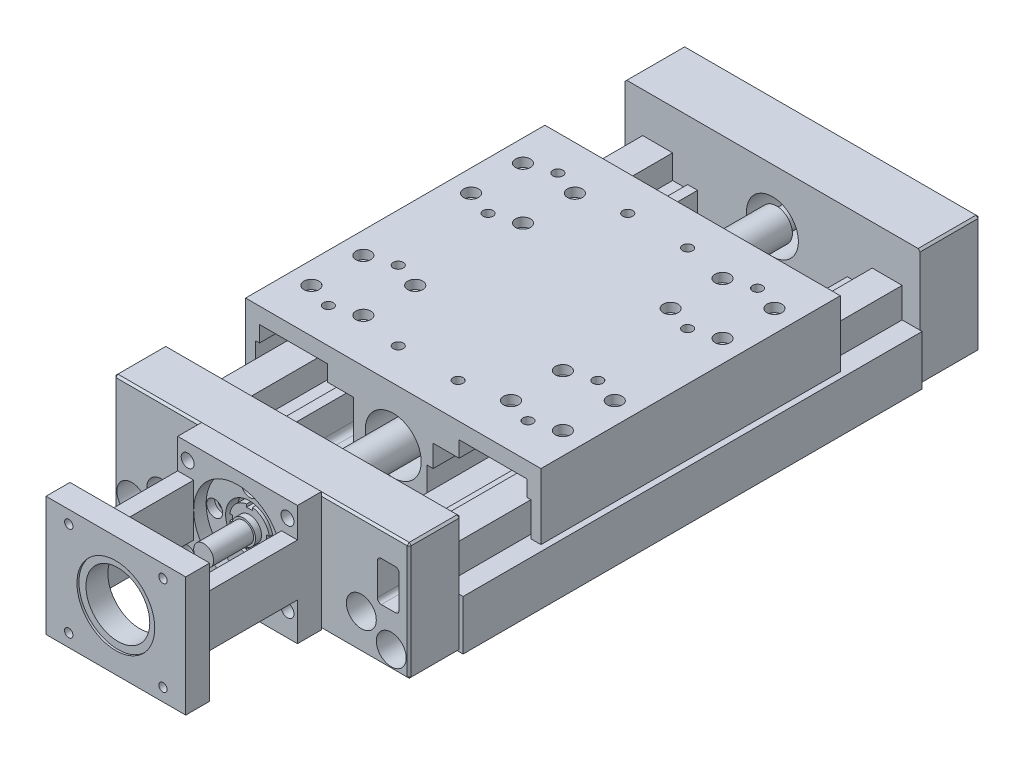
SolidWorks part; units mm, degrees
ref_plane "前视基准面" through (0, 0, 0) normal (0, 0, 1) x (1, 0, 0)
ref_plane "上视基准面" through (0, 0, 0) normal (0, 1, 0) x (1, 0, 0)
ref_plane "右视基准面" through (0, 0, 0) normal (1, 0, 0) x (0, 0, -1)
sketch "草图1" plane through (0, 0, 0) normal (0, 0, 1) x (1, 0, 0)
  line L0 (37.5, 30) -> (42.5, 30)
  line L1 (-75, 0) -> (75, 0)
  line L2 (-75, 0) -> (-75, 25)
  line L3 (-42.5, 30) -> (-37.5, 30)
  line L4 (75, 0) -> (75, 25)
  line L6 (-37.5, 30) -> (-37.5, 16)
  line L7 (-34.5, 13) -> (34.5, 13)
  line L8 (37.5, 30) -> (37.5, 16)
  line L10 (-42.5, 30) -> (-42.5, 28)
  line L11 (-42.5, 28) -> (-50, 28)
  line L12 (42.5, 30) -> (42.5, 28)
  line L13 (42.5, 28) -> (50, 28)
  line L14 (-50, 28) -> (-50, 25)
  line L15 (-50, 25) -> (-75, 25)
  line L18 (50, 28) -> (50, 25)
  line L19 (50, 25) -> (75, 25)
  arc A0 (37.5, 16) -> (34.5, 13) centre (34.5, 16) cw
  arc A1 (-37.5, 16) -> (-34.5, 13) centre (-34.5, 16) ccw
  point P0 (-75, 0)
  point P3 (75, 0)
  point P12 (37.5, 13)
  point P22 (-37.5, 13)
  dimension "D11" = 3
  dimension "D1" = 150
  dimension "D2" = 13
  dimension "D3" = 75
  dimension "D4" = 85
  dimension "D5" = 100
  dimension "D6" = 30
  dimension "D7" = 75
  dimension "D9" = 25
  dimension "D10" = 28
extrude "凸台-拉伸1" add sketch "草图1" along normal mid plane 230
ref_plane "基准面1" through (0, 0, 115) normal (0, 0, 1) x (1, 0, 0)
sketch "草图3" plane through (0, 0, 115) normal (0, 0, 1) x (1, 0, 0)
  line L1 (-74, 60) -> (74, 60)
  line L2 (-74, 60) -> (-74, 1)
  line L3 (-74, 1) -> (74, 1)
  line L4 (74, 60) -> (74, 1)
  dimension "D1" = 148
  dimension "D2" = 59
  dimension "D3" = 74
  dimension "D4" = 1
extrude "凸台-拉伸2" add sketch "草图3" along normal blind 26 separate body
ref_plane "基准面2" through (0, 0, -115) normal (0, 0, -1) x (-1, 0, 0)
sketch "草图4" plane through (0, 0, -115) normal (0, 0, -1) x (-1, 0, 0)
  line L1 (-74, 1) -> (74, 1)
  line L2 (-74, 1) -> (-74, 60)
  line L3 (-74, 60) -> (74, 60)
  line L4 (74, 1) -> (74, 60)
extrude "凸台-拉伸3" add sketch "草图4" along normal blind 30
sketch "草图5" plane through (0, 0, 141) normal (0, 0, 1) x (1, 0, 0)
  circle A0 centre (0, 33) radius 10
  dimension "D1" = 20
  dimension "D2" = 33
extrude "切除-拉伸1" cut sketch "草图5" against normal up to next
sketch "草图6" plane through (0, 0, 141) normal (0, 0, 1) x (1, 0, 0)
  circle A0 centre (0, 33) radius 14
  dimension "D1" = 28
extrude "切除-拉伸2" cut sketch "草图6" against normal blind 18
sketch "草图7" plane through (0, 0, -145) normal (0, 0, -1) x (-1, 0, 0)
  circle A0 centre (0, 33) radius 13
  dimension "D2" = 26
  dimension "D1" = 33
extrude "切除-拉伸3" cut sketch "草图7" against normal up to next
sketch "草图8" plane through (0, 0, 0) normal (0, 0, 1) x (1, 0, 0)
  line L0 (-20, 44) -> (-20, 24)
  line L1 (-74, 60) -> (74, 60)
  line L2 (-74, 60) -> (-74, 27)
  line L3 (-10, 14) -> (10, 14)
  line L4 (74, 60) -> (74, 27)
  line L5 (-20, 44) -> (-33, 44)
  line L6 (20, 44) -> (20, 33)
  line L7 (-33, 44) -> (-33, 52)
  line L8 (-33, 52) -> (-67, 52)
  line L9 (-67, 52) -> (-67, 44)
  line L10 (-67, 44) -> (-69, 44)
  line L11 (-69, 44) -> (-69, 27)
  line L12 (20, 33) -> (17, 33)
  line L13 (-69, 27) -> (-74, 27)
  line L14 (20, 44) -> (33, 44)
  line L15 (17, 33) -> (17, 21)
  line L16 (33, 44) -> (33, 52)
  line L17 (33, 52) -> (67, 52)
  line L18 (67, 52) -> (67, 44)
  line L19 (67, 44) -> (69, 44)
  line L20 (69, 44) -> (69, 27)
  line L21 (69, 27) -> (74, 27)
  line L22 (-20, 24) -> (-10, 14)
  line L23 (10, 14) -> (17, 21)
  circle A0 centre (0, 33) radius 10
  point P9 (-20, 14)
  point P12 (17, 14)
  dimension "D1" = 20
  dimension "D2" = 27
  dimension "D3" = 148
  dimension "D4" = 74
  dimension "D5" = 33
  dimension "D6" = 40
  dimension "D7" = 20
  dimension "D8" = 46
  dimension "D9" = 3
  dimension "D10" = 138
  dimension "D11" = 69
  dimension "D12" = 33
  dimension "D13" = 66
  dimension "D14" = 33
  dimension "D15" = 34
  dimension "D16" = 34
  dimension "D17" = 8
  dimension "D18" = 16
  dimension "D19" = 16
  dimension "D20" = 27
  dimension "D23" = 10
  dimension "D24" = 7
extrude "凸台-拉伸4" add sketch "草图8" along normal mid plane 150 separate body
sketch "草图9" plane through (0, 0, -75) normal (0, 0, -1) x (-1, 0, 0)
  line L1 (-33, 44) -> (30.2224, 44)
  line L2 (-33, 44) -> (-33, 7.4314)
  line L3 (-33, 7.4314) -> (30.2224, 7.4314)
  line L4 (30.2224, 44) -> (30.2224, 7.4314)
extrude "切除-拉伸4" cut sketch "草图9" against normal blind 60
sketch "草图10" plane through (0, 0, 75) normal (0, 0, 1) x (1, 0, 0)
  circle A0 centre (0, 33) radius 14
  dimension "D1" = 28
extrude "切除-拉伸5" cut sketch "草图10" against normal blind 50
hole_wizard "M6 螺纹孔1" positions "草图12" profile "草图11" tap size "M6" standard "GB"
sketch "草图12" plane through (0, 60, 0) normal (0, 1, 0) x (-1, 0, 0)
  point P0 (50, -57.5)
  point P1 (15, -57.5)
  point P3 (-15, -57.5)
  point P5 (-50, -57.5)
  point P7 (50, -22.5)
  point P9 (50, 22.5)
  point P11 (50, 57.5)
  point P17 (15, 57.5)
  point P23 (-15, 57.5)
  point P25 (-50, -22.5)
  point P27 (-50, 22.5)
  point P29 (-50, 57.5)
  dimension "D1" = 45
  dimension "D2" = 35
  dimension "D3" = 35
  dimension "D4" = 22.5
  dimension "D5" = 30
  dimension "D6" = 35
  dimension "D7" = 35
  dimension "D8" = 15
sketch "草图11" plane through (-50, 60, -57.5) normal (1, 0, 0) x (0, 0, 1)
  line L0 (0, 0) -> (0, 12.5022)
  line L1 (0, 12.5022) -> (2.5, 11)
  line L2 (2.5, 11) -> (2.5, 0)
  line L5 (2.5, 0) -> (0, 0)
  line L10 (0, 12.5022) -> (-2.5, 11) construction
  line L11 (0, -6.35) -> (0, 107.95) construction
  dimension "螺纹孔钻头直径" = 5
  dimension "螺纹孔钻头深度" = 11
  dimension "导头角度" = 118
hole_wizard "孔1" positions "草图15" profile "草图14" legacy
sketch "草图15" plane through (0, 60, 0) normal (0, 1, 0) x (-1, 0, 0)
  point P0 (-63, -53)
  point P1 (-63, -27)
  point P3 (-37, -53)
  point P5 (-37, -27)
  point P7 (-63, 27)
  point P9 (-63, 53)
  point P11 (-37, 27)
  point P13 (-37, 53)
  point P15 (63, 53)
  point P17 (63, 27)
  point P19 (37, 27)
  point P21 (37, 53)
  point P23 (63, -27)
  point P25 (63, -53)
  point P27 (37, -53)
  point P29 (37, -27)
  dimension "D1" = 26
  dimension "D2" = 26
  dimension "D3" = 26
  dimension "D4" = 26
  dimension "D5" = 54
  dimension "D6" = 27
  dimension "D7" = 74
  dimension "D8" = 37
sketch "草图14" plane through (63, 60, -53) normal (1, 0, 0) x (0, 0, 1)
  line L0 (0, 0) -> (0, 100)
  line L1 (0, 100) -> (2.25, 100)
  line L2 (2.25, 100) -> (2.25, 4.5)
  line L3 (2.25, 4.5) -> (3.75, 4.5)
  line L4 (3.75, 4.5) -> (3.75, 0)
  line L5 (3.75, 0) -> (0, 0)
  line L6 (0, 110) -> (0, -10) construction
  dimension "直径" = 4.5
  dimension "深度" = 100
  dimension "柱坑直径" = 7.5
  dimension "柱坑深度" = 4.5
ref_plane "基准面3" through (0, 33, 0) normal (0, 1, 0) x (-1, 0, 0)
sketch "草图17" plane through (0, 0, 141) normal (0, 0, 1) x (1, 0, 0)
  line L0 (58, 37) -> (69, 37) construction
  line L1 (60, 47) -> (67, 47)
  line L2 (58, 45) -> (58, 29)
  line L3 (60, 27) -> (67, 27)
  line L4 (69, 45) -> (69, 29)
  line L5 (-74, 1) -> (74, 1) construction
  line L6 (63.5, 47) -> (63.5, 27) construction
  arc A0 (69, 29) -> (67, 27) centre (67, 29) cw
  arc A1 (60, 27) -> (58, 29) centre (60, 29) cw
  arc A2 (58, 45) -> (60, 47) centre (60, 45) cw
  arc A3 (67, 47) -> (69, 45) centre (67, 45) cw
  point P14 (69, 27)
  point P17 (58, 27)
  point P22 (69, 47)
  dimension "D5" = 2
  dimension "D1" = 11
  dimension "D2" = 20
  dimension "D3" = 36
  dimension "D4" = 63.5
extrude "切除-拉伸6" cut sketch "草图17" against normal up to next
sketch "草图18" plane through (0, 0, 115) normal (0, 0, -1) x (-1, 0, 0)
  line L0 (-74, 1) -> (-74, 60) construction
  line L1 (-67, 47) -> (-34.5, 47)
  line L2 (-69, 45) -> (-69, 29)
  line L3 (-67, 27) -> (-34.5, 27)
  line L4 (-32.5, 45) -> (-32.5, 29)
  line L5 (-74, 60) -> (74, 60) construction
  arc A0 (-67, 27) -> (-69, 29) centre (-67, 29) cw
  arc A1 (-67, 47) -> (-69, 45) centre (-67, 45) ccw
  arc A2 (-34.5, 27) -> (-32.5, 29) centre (-34.5, 29) ccw
  arc A3 (-32.5, 45) -> (-34.5, 47) centre (-34.5, 45) ccw
  point P10 (-69, 27)
  point P13 (-69, 47)
  point P18 (-32.5, 47)
  dimension "D5" = 2
  dimension "D6" = 2
  dimension "D1" = 20
  dimension "D2" = 5
  dimension "D3" = 13
  dimension "D4" = 36.5
extrude "切除-拉伸7" cut sketch "草图18" against normal blind 10
hole_wizard "M6 螺纹孔2" positions "草图20" profile "草图19" tap size "M6" standard "GB"
sketch "草图20" plane through (0, 0, 141) normal (0, 0, 1) x (1, 0, 0)
  line L0 (-74, 1) -> (74, 1) construction
  point P0 (-25, 53)
  point P1 (25, 53)
  point P3 (-25, 13)
  point P5 (25, 13)
  dimension "D1" = 40
  dimension "D2" = 50
  dimension "D3" = 25
  dimension "D4" = 52
sketch "草图19" plane through (-25, 53, 141) normal (1, 0, 0) x (0, -1, 0)
  line L0 (0, 0) -> (0, 16.5022)
  line L1 (0, 16.5022) -> (2.5, 15)
  line L2 (2.5, 15) -> (2.5, 0)
  line L5 (2.5, 0) -> (0, 0)
  line L10 (0, 16.5022) -> (-2.5, 15) construction
  line L11 (0, -6.35) -> (0, 107.95) construction
  dimension "螺纹孔钻头直径" = 5
  dimension "螺纹孔钻头深度" = 15
  dimension "导头角度" = 118
chamfer "倒角1" distance 1 angle 45 12 edges at (0, 1, 115) (74, 30.5, 115) (74, 1, 128) (0, 1, 141) (74, 30.5, 141) (74, 60, 128) (0, 60, 115) (-74, 1, 128) (-74, 30.5, 115) (-74, 30.5, 141) (-74, 60, 128) (0, 60, 141)
hole_wizard "孔2" positions "草图23" profile "草图22" legacy
sketch "草图23" plane through (0, 0, 141) normal (0, 0, 1) x (1, 0, 0)
  line L0 (73, 1) -> (-73, 1) construction
  point P0 (-65, 10)
  point P1 (-50, 19)
  point P3 (50, 19)
  point P5 (65, 10)
  dimension "D1" = 130
  dimension "D2" = 65
  dimension "D3" = 100
  dimension "D4" = 50
  dimension "D5" = 9
  dimension "D6" = 18
sketch "草图22" plane through (-65, 10, 141) normal (1, 0, 0) x (0, -1, 0)
  line L0 (0, 0) -> (0, 100)
  line L1 (0, 100) -> (4.5, 100)
  line L2 (4.5, 100) -> (4.5, 16)
  line L3 (4.5, 16) -> (7.5, 16)
  line L4 (7.5, 16) -> (7.5, 0)
  line L5 (7.5, 0) -> (0, 0)
  line L6 (0, 110) -> (0, -10) construction
  dimension "直径" = 9
  dimension "深度" = 100
  dimension "柱坑直径" = 15
  dimension "柱坑深度" = 16
hole_wizard "孔3" positions "草图26" profile "草图25" legacy
sketch "草图26" plane through (0, 0, -145) normal (0, 0, -1) x (-1, 0, 0)
  line L0 (-74, 1) -> (74, 1) construction
  point P0 (-65, 10)
  point P1 (-50, 19)
  point P3 (65, 10)
  point P5 (50, 19)
  dimension "D1" = 100
  dimension "D2" = 130
  dimension "D3" = 50
  dimension "D4" = 65
  dimension "D5" = 9
  dimension "D6" = 18
sketch "草图25" plane through (65, 10, -145) normal (1, 0, 0) x (0, 1, 0)
  line L0 (0, 0) -> (0, 100)
  line L1 (0, 100) -> (4.5, 100)
  line L2 (4.5, 100) -> (4.5, 16)
  line L3 (4.5, 16) -> (7.5, 16)
  line L4 (7.5, 16) -> (7.5, 0)
  line L5 (7.5, 0) -> (0, 0)
  line L6 (0, 110) -> (0, -10) construction
  dimension "直径" = 9
  dimension "深度" = 100
  dimension "柱坑直径" = 15
  dimension "柱坑深度" = 16
sketch "草图28" plane through (0, 0, 141) normal (0, 0, 1) x (1, 0, 0)
  line L0 (82.5, 33) -> (-82.5, 33) construction
  line L1 (-30, 61) -> (30, 61)
  line L2 (-30, 61) -> (-30, 1)
  line L3 (-30, 1) -> (30, 1)
  line L4 (30, 61) -> (30, 1)
  circle A0 centre (0, 33) radius 22
  circle A1 centre (-25, 53) radius 3.25
  circle A2 centre (25, 53) radius 3.25
  circle A3 centre (25, 13) radius 3.25
  circle A4 centre (-25, 13) radius 3.25
  dimension "D5" = 44
  dimension "D6" = 6.5
  dimension "D1" = 60
  dimension "D2" = 60
  dimension "D3" = 28
  dimension "D4" = 30
extrude "凸台-拉伸5" add sketch "草图28" along normal blind 12
sketch "草图29" plane through (0, 0, 153) normal (0, 0, 1) x (1, 0, 0)
  line L0 (-30, 59) -> (-30, 2) construction
  line L1 (-30, 46) -> (-22, 46)
  line L2 (-30, 46) -> (-30, 20)
  line L3 (-30, 20) -> (-22, 20)
  line L4 (-22, 46) -> (-22, 20)
  line L5 (30, 1) -> (30, 61) construction
  line L6 (30, 46) -> (22, 46)
  line L7 (30, 46) -> (30, 20)
  line L8 (30, 20) -> (22, 20)
  line L9 (22, 46) -> (22, 20)
  line L10 (82.5, 33) -> (-82.5, 33) construction
  dimension "D1" = 26
  dimension "D2" = 13
  dimension "D3" = 8
  dimension "D4" = 8
extrude "凸台-拉伸6" add sketch "草图29" along normal blind 49
sketch "草图30" plane through (0, 0, 202) normal (0, 0, 1) x (1, 0, 0)
  line L0 (82.5, 33) -> (-82.5, 33) construction
  line L1 (-35, 63) -> (35, 63)
  line L2 (-35, 63) -> (-35, 3)
  line L3 (-35, 3) -> (35, 3)
  line L4 (35, 63) -> (35, 3)
  circle A0 centre (0, 33) radius 16
  dimension "D5" = 32
  dimension "D1" = 60
  dimension "D2" = 30
  dimension "D3" = 70
  dimension "D4" = 35
extrude "凸台-拉伸7" add sketch "草图30" along normal blind 12
hole_wizard "M5 螺纹孔1" positions "草图32" profile "草图31" tap size "M5" standard "GB"
sketch "草图32" plane through (0, 0, 214) normal (0, 0, 1) x (1, 0, 0)
  line L0 (82.5, 33) -> (-82.5, 33) construction
  point P0 (-23.6, 56.6)
  point P1 (-23.6, 9.4)
  point P3 (23.6, 9.4)
  point P5 (23.6, 56.6)
  dimension "D1" = 47.2
  dimension "D2" = 47.2
  dimension "D3" = 23.6
  dimension "D4" = 23.6
sketch "草图31" plane through (-23.6, 56.6, 214) normal (1, 0, 0) x (0, -1, 0)
  line L0 (0, 0) -> (0, 13.6618)
  line L1 (0, 13.6618) -> (2.1, 12.4)
  line L2 (2.1, 12.4) -> (2.1, 0)
  line L5 (2.1, 0) -> (0, 0)
  line L10 (0, 13.6618) -> (-2.1, 12.4) construction
  line L11 (0, -6.35) -> (0, 107.95) construction
  dimension "螺纹孔钻头直径" = 4.2
  dimension "螺纹孔钻头深度" = 12.4
  dimension "导头角度" = 118
sketch "草图33" plane through (0, 0, 214) normal (0, 0, 1) x (1, 0, 0)
  circle A0 centre (0, 33) radius 19.5
  dimension "D1" = 39
extrude "切除-拉伸8" cut sketch "草图33" against normal blind 1
sketch "草图34" plane through (0, 0, 0) normal (0, 0, 1) x (1, 0, 0)
  line L1 (-50, 25) -> (-65, 25)
  line L2 (-50, 25) -> (-50, 40)
  line L3 (-50, 40) -> (-65, 40)
  line L4 (-65, 25) -> (-65, 40)
  line L5 (50, 25) -> (65, 25)
  line L6 (50, 25) -> (50, 40)
  line L7 (50, 40) -> (65, 40)
  line L8 (65, 25) -> (65, 40)
  dimension "D1" = 15
  dimension "D2" = 15
  dimension "D3" = 15
extrude "凸台-拉伸8" add sketch "草图34" against normal up to surface (115 mm away) separate body
mirror "镜向2" about plane through (0, 0, 0) normal (0, 0, 1) of "凸台-拉伸8"
sketch "草图35" plane through (0, 0, 0) normal (1, 0, 0) x (0, 0, -1)
  line L0 (75, 60) -> (81.25, 53.7545)
  line L1 (81.25, 53.7545) -> (87.5, 60.0091)
  line L2 (75, 60) -> (75, 59)
  line L3 (75, 27) -> (75, 60) construction
  line L4 (75, 59) -> (81.25, 52.7545)
  line L5 (81.25, 52.7545) -> (87.5, 59.0091)
  line L6 (87.5, 59.0091) -> (87.5, 60.0091)
  dimension "D1" = 12.5
  dimension "D2" = 1
  dimension "D3" = 6.2545
  dimension "D4" = 7.2455
extrude "凸台-拉伸9" [suppressed] add sketch "草图35" along normal mid plane 148
sketch "草图36" [suppressed] plane through (0, 60, 0) normal (0, 1, 0) x (1, 0, 0)
  line L0 (-74, 75) -> (-67.75, 81.25)
  line L1 (74, 81.25) -> (-74, 81.25) construction
  line L2 (-67.75, 81.25) -> (-74, 87.5)
  line L3 (-74, 87.5) -> (-74, 75)
  line L4 (74, 87.5) -> (67.75, 81.25)
  line L5 (67.75, 81.25) -> (74, 75)
  line L6 (74, 87.5) -> (74, 75)
  dimension "D1" = 90
  dimension "D2" = 90
extrude "切除-拉伸9" [suppressed] cut sketch "草图36" against normal up to next
sketch "草图37" [suppressed] plane through (0, 60, 0) normal (0, 1, 0) x (1, 0, 0)
  line L0 (-74, 75) -> (-67.75, 81.25)
  line L1 (-67.75, 81.25) -> (-74, 87.5)
  line L2 (-74, 87.5) -> (-73, 87.5)
  line L3 (74, 87.5) -> (-74, 87.5) construction
  line L4 (-73, 87.5) -> (-66.75, 81.25)
  line L5 (67.75, 81.25) -> (-67.75, 81.25) construction
  line L6 (-66.75, 81.25) -> (-73, 75)
  line L7 (74, 75) -> (-74, 75) construction
  line L8 (-73, 75) -> (-74, 75)
  line L9 (74, 75) -> (67.75, 81.25)
  line L10 (67.75, 81.25) -> (74, 87.5)
  line L11 (74, 87.5) -> (73, 87.5)
  line L12 (73, 87.5) -> (66.75, 81.25)
  line L13 (66.75, 81.25) -> (73, 75)
  line L14 (73, 75) -> (74, 75)
  dimension "D1" = 1
  dimension "D2" = 1
extrude "凸台-拉伸10" [suppressed] add sketch "草图37" against normal up to surface (35 mm away)
sketch "草图38" [suppressed] plane through (0, 0, 0) normal (1, 0, 0) x (0, 0, -1)
  line L0 (75, 60) -> (81.25, 53.7545)
  line L1 (81.25, 25) -> (81.25, 60) construction
  line L2 (81.25, 53.7545) -> (87.4909, 60)
  line L3 (75, 60) -> (87.4909, 60)
extrude "切除-拉伸10" [suppressed] cut sketch "草图38" against normal mid plane 148
pattern_linear "阵列(线性)1" [suppressed] count 8 spacing 12.5
mirror "镜向3" [suppressed] about plane through (0, 0, 0) normal (0, 0, 1)
sketch "草图39" plane through (0, 33, 0) normal (0, 1, 0) x (-1, 0, 0)
  line L0 (0, 305.5936) -> (0, -249.1557) construction
  line L1 (8, 123) -> (8, -117)
  line L2 (8, -117) -> (5, -117)
  line L3 (5, -117) -> (5, -144)
  line L4 (5, -144) -> (0, -144)
  line L5 (8, 123) -> (6, 123)
  line L6 (6, 123) -> (6, 150)
  line L7 (5, 170) -> (0, 170)
  line L8 (-75, -115) -> (-74, -115) construction
  line L9 (33.005, 115) -> (-33.005, 115) construction
  line L10 (0, 170) -> (0, -144)
  line L12 (5, 170) -> (5, 150)
  line L13 (5, 150) -> (6, 150)
  dimension "D1" = 8
  dimension "D2" = 47
  dimension "D3" = 5
  dimension "D4" = 2
  dimension "D5" = 8
  dimension "D6" = 6
  dimension "D7" = 27
  dimension "D8" = 5
  dimension "D9" = 27
revolve "旋转1" add sketch "草图39" angle 360 about L0
sketch "草图40" plane through (0, 0, 141) normal (0, 0, 1) x (1, 0, 0)
  circle A0 centre (0, 33) radius 21.75
  circle A1 centre (0, 33) radius 12
  dimension "D1" = 43.5
  dimension "D2" = 24
extrude "凸台-拉伸11" add sketch "草图40" along normal blind 6
hole_wizard "孔4" positions "草图42" profile "草图41" legacy
sketch "草图42" plane through (0, 0, 147) normal (0, 0, 1) x (1, 0, 0)
  circle A0 centre (0, 33) radius 17.5 construction
  point P0 (-17.5, 33)
  point P6 (0, 50.5)
  point P8 (17.5, 33)
  point P10 (0, 15.5)
  dimension "D1" = 35
sketch "草图41" plane through (-17.5, 33, 147) normal (1, 0, 0) x (0, -1, 0)
  line L0 (0, 0) -> (0, 6)
  line L1 (0, 6) -> (2.25, 6)
  line L2 (2.25, 6) -> (2.25, 4)
  line L3 (2.25, 4) -> (4, 4)
  line L4 (4, 4) -> (4, 0)
  line L5 (4, 0) -> (0, 0)
  line L6 (0, 110) -> (0, -10) construction
  dimension "直径" = 4.5
  dimension "深度" = 6
  dimension "柱坑直径" = 8
  dimension "柱坑深度" = 4
sketch "草图43" plane through (0, 0, 147) normal (0, 0, 1) x (1, 0, 0)
  line L0 (82.5, 33) -> (-82.5, 33) construction
  line L2 (-1.5, 42.8869) -> (-1.5, 41.5)
  line L3 (-1.5, 41.5) -> (1.5, 41.5)
  line L4 (1.5, 42.8869) -> (1.5, 41.5)
  line L7 (-9.8869, 34.5) -> (-8.5, 34.5)
  line L9 (-9.8869, 31.5) -> (-8.5, 31.5)
  line L10 (-8.5, 34.5) -> (-8.5, 31.5)
  line L11 (8.5, 34.5) -> (9.8869, 34.5)
  line L12 (8.5, 34.5) -> (8.5, 31.5)
  line L13 (8.5, 31.5) -> (9.8869, 31.5)
  line L15 (-1.5, 24.5) -> (1.5, 24.5)
  line L16 (-1.5, 24.5) -> (-1.5, 23.1131)
  line L18 (1.5, 24.5) -> (1.5, 23.1131)
  arc A0 (-1.5, 42.8869) -> (-9.8869, 34.5) centre (0, 33) ccw
  arc A1 (1.5, 23.1131) -> (9.8869, 31.5) centre (0, 33) ccw
  arc A2 (-9.8869, 31.5) -> (-1.5, 23.1131) centre (0, 33) ccw
  arc A3 (9.8869, 34.5) -> (1.5, 42.8869) centre (0, 33) ccw
  circle A4 centre (0, 33) radius 6
  dimension "D1" = 20
  dimension "D2" = 8.5
  dimension "D4" = 1.5
  dimension "D5" = 8.5
  dimension "D6" = 1.5
  dimension "D7" = 1.5
  dimension "D8" = 17
  dimension "D9" = 8.5
  dimension "D10" = 1.5
extrude "凸台-拉伸12" add sketch "草图43" against normal blind 8
chamfer "倒角2" distance 1 angle 45 8 edges at (0, 1, -145) (74, 1, -130) (74, 30.5, -145) (74, 60, -130) (-74, 1, -130) (0, 60, -145) (-74, 60, -130) (-74, 30.5, -145)
sketch "草图44" plane through (0, 0, 115) normal (0, 0, 1) x (1, 0, 0)
  line L0 (-30, 1) -> (30, 1) construction
  line L1 (-30, -3.1097) -> (30, -3.1097)
  line L2 (-30, -3.1097) -> (-30, 1)
  line L3 (-30, 1) -> (30, 1)
  line L4 (30, -3.1097) -> (30, 1)
  line L5 (0, 0) -> (0, -3.1097) construction
  dimension "D1" = 60
extrude "切除-拉伸11" [suppressed] cut sketch "草图44" against normal through all
